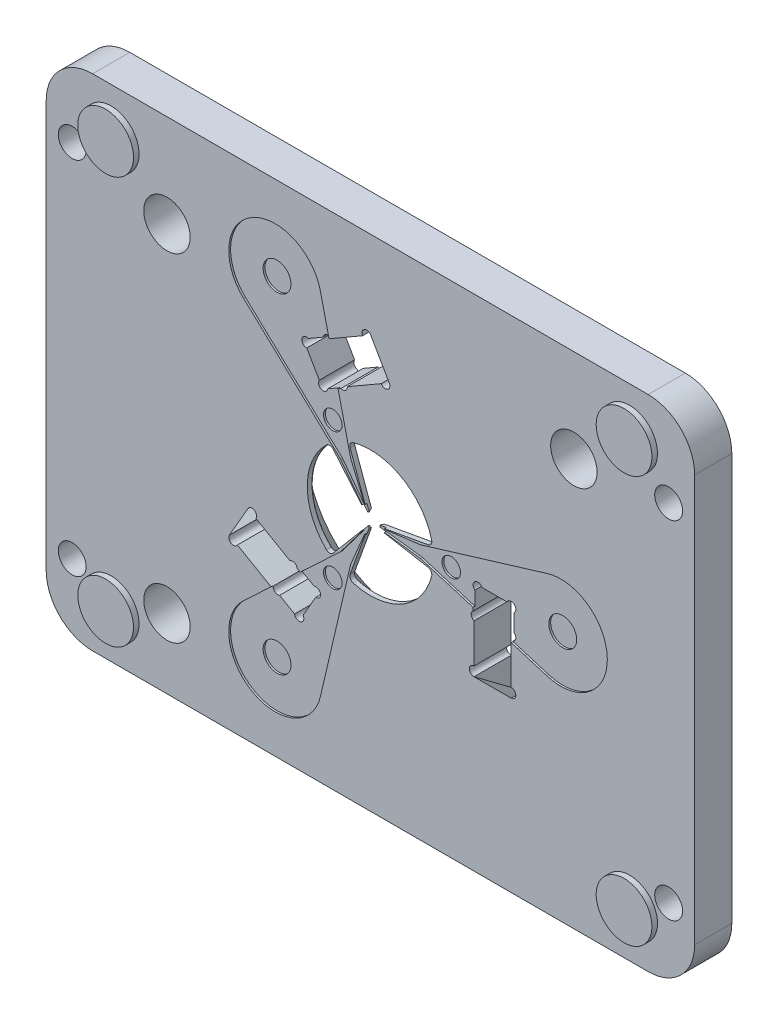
SolidWorks part; units mm, degrees
ref_plane "前基準面" through (0, 0, 0) normal (0, 0, 1) x (1, 0, 0)
ref_plane "上基準面" through (0, 0, 0) normal (0, 1, 0) x (1, 0, 0)
ref_plane "右基準面" through (0, 0, 0) normal (1, 0, 0) x (0, 0, -1)
sketch "草圖1" plane through (0, 0, 0) normal (0, 0, 1) x (1, 0, 0)
  line L1 (-38, 30) -> (38, 30)
  line L2 (-38, 30) -> (-38, -30)
  line L3 (-38, -30) -> (38, -30)
  line L4 (38, 30) -> (38, -30)
  line L5 (-38, 30) -> (38, -30) construction
  line L6 (-38, -30) -> (38, 30) construction
  point P0 (0, 0)
  point P28 (0, 0)
  dimension "D1" = 76
  dimension "D2" = 60
extrude "填料-伸長1" add sketch "草圖1" along normal blind 4
sketch "草圖2" plane through (0, 0, 4) normal (0, 0, 1) x (1, 0, 0)
  line L6 (0.3574, 0.005) -> (20.1903, 2.4807) construction
  line L7 (0.3574, -0.005) -> (20.1903, -2.4807) construction
  line L8 (0.3574, 0.005) -> (4.5094, 0.5233)
  line L9 (0.3574, -0.005) -> (4.5094, -0.5233)
  line L10 (6.1751, 0.8773) -> (19.0478, 4.7845)
  line L11 (6.1751, -0.8773) -> (19.0478, -4.7845)
  line L12 (-2.3278, -5.7864) -> (-5.3804, -18.8881)
  line L13 (-0.1744, -0.312) -> (-1.8015, -4.1669)
  line L14 (-0.183, -0.307) -> (-2.7079, -3.6436)
  line L15 (-3.8473, -4.9091) -> (-13.6674, -14.1037)
  line L16 (-3.8473, 4.9091) -> (-13.6674, 14.1037)
  line L17 (-0.183, 0.307) -> (-2.7079, 3.6436)
  line L18 (-0.1744, 0.312) -> (-1.8015, 4.1669)
  line L19 (-2.3278, 5.7864) -> (-5.3804, 18.8881)
  circle A7 centre (0, 0) radius 0.353 construction
  arc A8 (0.3574, 0.005) -> (0.3574, -0.005) centre (0.358, 0) ccw
  arc A9 (19.0478, -4.7845) -> (19.0478, 4.7845) centre (20.5, 0) ccw
  circle A10 centre (20.5, 0) radius 2.5 construction
  arc A11 (4.5094, -0.5233) -> (6.1751, -0.8773) centre (3.2707, -10.4463) cw
  arc A12 (4.5094, 0.5233) -> (6.1751, 0.8773) centre (3.2707, 10.4463) ccw
  arc A13 (-13.6674, -14.1037) -> (-5.3804, -18.8881) centre (-10.25, -17.7535) ccw
  arc A14 (-1.8015, -4.1669) -> (-2.3278, -5.7864) centre (7.4114, -8.0556) ccw
  arc A15 (-0.1744, -0.312) -> (-0.183, -0.307) centre (-0.179, -0.31) ccw
  arc A16 (-2.7079, -3.6436) -> (-3.8473, -4.9091) centre (-10.6821, 2.3906) cw
  arc A17 (-5.3804, 18.8881) -> (-13.6674, 14.1037) centre (-10.25, 17.7535) ccw
  arc A18 (-2.7079, 3.6436) -> (-3.8473, 4.9091) centre (-10.6821, -2.3906) ccw
  arc A19 (-0.183, 0.307) -> (-0.1744, 0.312) centre (-0.179, 0.31) ccw
  arc A20 (-1.8015, 4.1669) -> (-2.3278, 5.7864) centre (7.4114, 8.0556) cw
  point P17 (5.3574, -0.6291)
  point P20 (5.3574, 0.6291)
  point P46 (0, 0)
  dimension "D1" = 0.706
  dimension "D2" = 0.01
  dimension "D3" = 10
  dimension "D6" = 5
  dimension "D4" = 5
  dimension "D7" = 10
  dimension "D9" = 0.6201
  dimension "D5" = 20.5
  dimension "D8" = 3
extrude "除料-伸長1" cut sketch "草圖2" against normal blind 0.5
sketch "草圖5" plane through (0, 0, 4) normal (0, 0, 1) x (1, 0, 0)
  line L0 (-29.9, 26.9) -> (29.9, 26.9)
  line L1 (-38, 30) -> (-38, -30) construction
  line L2 (38, -30) -> (38, 30) construction
  line L3 (34.9, 21.9) -> (34.9, -21.9)
  line L4 (38, 30) -> (-38, 30) construction
  line L5 (-38, -30) -> (38, -30) construction
  line L6 (-29.9, -26.9) -> (29.9, -26.9)
  line L7 (-34.9, 21.9) -> (-34.9, -21.9)
  arc A0 (-29.9, -26.9) -> (-34.9, -21.9) centre (-29.9, -21.9) cw
  arc A1 (34.9, -21.9) -> (29.9, -26.9) centre (29.9, -21.9) cw
  arc A2 (29.9, 26.9) -> (34.9, 21.9) centre (29.9, 21.9) cw
  arc A3 (-34.9, 21.9) -> (-29.9, 26.9) centre (-29.9, 21.9) cw
  dimension "D5" = 5
  dimension "D1" = 3.1
  dimension "D2" = 3.1
  dimension "D3" = 3.1
  dimension "D4" = 3.1
extrude "除料-伸長4" cut sketch "草圖5" against normal blind 10 contours L7 A3 L0 A2 L3 A1 L6 A0 M32 M29 M30 M31
ref_plane "平面1" through (0, 0, 4) normal (0, 0, 1) x (1, 0, 0)
sketch "草圖7" plane through (0, 0, 4) normal (0, 0, 1) x (1, 0, 0)
  line L0 (0, 0) -> (34.9, 0) construction
  line L1 (34.9, 21.9) -> (34.9, -21.9) construction
  line L2 (11.05, -0.2286) -> (15.25, -0.2286)
  line L3 (15.25, -0.2286) -> (15.25, -3.3286)
  line L4 (15.25, -3.3286) -> (11.05, -3.3286)
  line L5 (11.05, -3.3286) -> (11.05, -0.2286)
  line L6 (11.05, -1.7786) -> (15.25, -1.7786) construction
  line L7 (13.15, -0.2286) -> (13.15, -3.3286) construction
  line L8 (13.15, -1.7786) -> (11.05, -0.2286) construction
  line L9 (0, 0) -> (-12.75, -22.0836) construction
  line L10 (-6.575, -11.3882) -> (-6.9709, -11.1597) construction
  line L11 (-5.7229, -9.4553) -> (-7.8229, -13.0926)
  line L16 (-7.4271, 13.3212) -> (-5.3271, 9.6839)
  line L17 (-7.4271, 13.3212) -> (-4.7424, 14.8712)
  line L18 (-4.7424, 14.8712) -> (-2.6424, 11.2339)
  line L23 (13.15, -1.7786) -> (13.15, -13.7786) construction
  line L24 (11.15, -7.7786) -> (15.15, -7.7786)
  line L25 (11.15, -7.7786) -> (11.15, -8.7786)
  line L26 (11.15, -8.7786) -> (15.15, -8.7786)
  line L27 (15.15, -8.7786) -> (15.15, -7.7786)
  line L28 (-2.6424, 11.2339) -> (-5.3271, 9.6839)
  line L33 (-6.0847, 14.0962) -> (-3.9847, 10.4589) construction
  line L34 (11.15, -8.2786) -> (15.15, -8.2786) construction
  line L35 (-5.7229, -9.4553) -> (-8.4076, -7.9053)
  line L40 (-8.4076, -7.9053) -> (-10.5076, -11.5426)
  line L41 (0, 0) -> (-12.75, 22.0836) construction
  line L42 (-6.575, 11.3882) -> (-6.1791, 11.6168) construction
  line L43 (-6.3771, 11.5025) -> (-3.6924, 13.0525) construction
  line L44 (-10.5076, -11.5426) -> (-7.8229, -13.0926)
  line L45 (-7.0653, -8.6803) -> (-9.1653, -12.3176) construction
  line L46 (-9.4576, -9.7239) -> (-6.7729, -11.2739) construction
  line L47 (-8.4076, -7.9053) -> (-7.8229, -13.0926) construction
  line L48 (-10.5076, -11.5426) -> (-5.7229, -9.4553) construction
  line L49 (-9.4576, -9.7239) -> (-17.1653, -5.2739) construction
  line L50 (-12.3114, -5.7669) -> (-14.3114, -9.231)
  line L51 (-4.7424, 14.8712) -> (-5.3271, 9.6839) construction
  line L52 (-7.4271, 13.3212) -> (-2.6424, 11.2339) construction
  line L53 (-3.6924, 13.0525) -> (4.0153, 17.5025) construction
  line L54 (-0.8386, 17.0096) -> (1.1614, 13.5455)
  line L55 (-0.8386, 17.0096) -> (0.0275, 17.5096)
  line L56 (0.0275, 17.5096) -> (2.0275, 14.0455)
  line L57 (2.0275, 14.0455) -> (1.1614, 13.5455)
  line L58 (-0.4055, 17.2596) -> (1.5945, 13.7955) construction
  line L59 (-4.3091, 13.6779) -> (-3.8841, 12.9418) construction
  line L60 (-4.7841, 14.5007) -> (-4.3091, 13.6779) construction
  line L61 (-12.3114, -5.7669) -> (-13.1775, -5.2669)
  line L62 (-13.1775, -5.2669) -> (-15.1775, -8.731)
  line L63 (-15.1775, -8.731) -> (-14.3114, -9.231)
  line L64 (-12.7445, -5.5169) -> (-14.7445, -8.981) construction
  line L65 (-10.1659, -11.3935) -> (-9.6909, -10.5708) construction
  line L66 (-9.6909, -10.5708) -> (-9.2659, -9.8347) construction
  circle A0 centre (11.35, -0.45) radius 0.5
  circle A1 centre (14.95, -0.45) radius 0.5
  circle A2 centre (14.95, -3.1071) radius 0.5
  circle A3 centre (11.35, -3.1071) radius 0.5
  circle A4 centre (13.15, -0.9886) radius 0.15 construction
  arc A11 (-13.6674, -14.1037) -> (-5.3804, -18.8881) centre (-10.25, -17.7535) ccw construction
  circle A17 centre (-7.0853, 13.1721) radius 0.5
  circle A20 centre (15.15, -8.2786) radius 0.5
  circle A21 centre (11.15, -8.2786) radius 0.5
  arc A24 (-5.3804, 18.8881) -> (-13.6674, 14.1037) centre (-10.25, 17.7535) ccw construction
  circle A25 centre (-7.8647, -12.7221) radius 0.5
  circle A26 centre (-10.1659, -11.3935) radius 0.5
  circle A27 centre (-6.0647, -9.6044) radius 0.5
  circle A28 centre (-8.3659, -8.2758) radius 0.5
  circle A29 centre (-14.7445, -8.981) radius 0.5
  circle A30 centre (-12.7445, -5.5169) radius 0.5
  circle A31 centre (-4.7841, 14.5007) radius 0.5
  circle A32 centre (-2.9841, 11.383) radius 0.5
  circle A33 centre (-5.2853, 10.0544) radius 0.5
  circle A34 centre (-0.4055, 17.2596) radius 0.5
  circle A35 centre (1.5945, 13.7955) radius 0.5
  point P24 (13.15, -7.7786)
  point P37 (-6.7729, -11.2739)
  point P52 (-6.3771, 11.5025)
  point P70 (0.1614, 15.2775)
  point P89 (-13.3114, -7.4989)
  dimension "D3" = 1
  dimension "D4" = 0.3
  dimension "D10" = 13.15
  dimension "D23" = 0.3
  dimension "D17" = 1
  dimension "D24" = 0.45
  dimension "D25" = 4
  dimension "D30" = 0.45
  dimension "D20" = 1
  dimension "D1" = 4.2
  dimension "D2" = 3.1
  dimension "D5" = 0.79
  dimension "D6" = 0.45
  dimension "D7" = 13.15
  dimension "D11" = 13.15
  dimension "D12" = 4.2
  dimension "D13" = 4
  dimension "D14" = 1
  dimension "D15" = 4.2
  dimension "D16" = 3.1
  dimension "D18" = 4.95
  dimension "D19" = 3.1
  dimension "D21" = 0.3
  dimension "D22" = 0.3
  dimension "D26" = 1
  dimension "D27" = 4.95
  dimension "D29" = 1.25
  dimension "D31" = 4
  dimension "D32" = 1
  dimension "D33" = 4.95
  dimension "D35" = 1.25
extrude "除料-伸長5" cut sketch "草圖7" against normal through all
sketch "草圖9" plane through (0, 0, 4) normal (0, 0, 1) x (1, 0, 0)
  line L0 (34.9, 21.9) -> (24.9, 21.9) construction
  line L1 (24.9, 21.9) -> (24.9, -21.9) construction
  line L2 (24.9, -21.9) -> (34.9, -21.9) construction
  line L3 (34.9, 21.9) -> (34.9, -21.9) construction
  line L4 (0, 26.9) -> (0, -26.9) construction
  line L5 (-29.9, 26.9) -> (29.9, 26.9) construction
  line L6 (-29.9, -26.9) -> (29.9, -26.9) construction
  line L7 (34.9, 0) -> (-34.9, 0) construction
  line L8 (-34.9, 21.9) -> (-34.9, -21.9) construction
  circle A0 centre (32.1, 17.9) radius 1.5
  circle A3 centre (-32.1, 19.4) radius 1.5
  circle A4 centre (-32.1, -19.4) radius 1.5
  circle A5 centre (32.1, -19.4) radius 1.5
  dimension "D2" = 3
  dimension "D5" = 2.8
  dimension "D3" = 3
  dimension "D7" = 2.8
  dimension "D1" = 10
  dimension "D4" = 4
  dimension "D6" = 2.5
extrude "除料-伸長6" cut sketch "草圖9" against normal through all
sketch "草圖13" plane through (0, 0, 4) normal (0, 0, 1) x (1, 0, 0)
  line L0 (5.358, 0.6292) -> (19.0478, 4.7845) construction
  line L1 (0.3574, 0.005) -> (20.1903, 2.4807) construction
  line L2 (20.1903, -2.4807) -> (0.3574, -0.005) construction
  line L15 (0.3574, 0.005) -> (5.358, 0.6292) construction
  line L16 (0.3574, -0.005) -> (5.358, -0.6292) construction
  line L17 (5.358, -0.6292) -> (19.0478, -4.7845) construction
  line L18 (-2.1341, -4.9548) -> (-5.3804, -18.8881) construction
  line L19 (-0.1744, -0.312) -> (-2.1341, -4.9548) construction
  line L20 (-0.183, -0.307) -> (-3.2239, -4.3256) construction
  line L21 (-3.2239, -4.3256) -> (-13.6673, -14.1036) construction
  line L22 (-3.2239, 4.3256) -> (-13.6673, 14.1036) construction
  line L23 (-0.183, 0.307) -> (-3.2239, 4.3256) construction
  line L24 (-0.1744, 0.312) -> (-2.1341, 4.9548) construction
  line L25 (-2.1341, 4.9548) -> (-5.3804, 18.8881) construction
  line L41 (0.3574, 0.005) -> (6.1962, 1.0512)
  line L42 (0.3574, -0.005) -> (6.1962, -1.0512)
  line L43 (-0.183, -0.307) -> (-4.0085, -4.8405)
  line L44 (-0.1744, -0.312) -> (-2.1877, -5.8917)
  line L45 (-0.1744, 0.312) -> (-2.1877, 5.8917)
  line L46 (-0.183, 0.307) -> (-4.0085, 4.8405)
  circle A8 centre (0, 0) radius 0.353 construction
  arc A9 (0.3574, 0.005) -> (0.3574, -0.005) centre (0.358, 0) ccw construction
  circle A10 centre (20.5, 0) radius 2.5 construction
  arc A11 (19.0478, -4.7845) -> (19.0478, 4.7845) centre (20.5, 0) ccw construction
  arc A12 (-13.6673, -14.1036) -> (-5.3804, -18.8881) centre (-10.25, -17.7535) ccw construction
  arc A13 (-0.1744, -0.312) -> (-0.183, -0.307) centre (-0.179, -0.31) ccw construction
  arc A14 (-5.3804, 18.8881) -> (-13.6673, 14.1036) centre (-10.25, 17.7535) ccw construction
  arc A15 (-0.183, 0.307) -> (-0.1744, 0.312) centre (-0.179, 0.31) ccw construction
  arc A16 (-4.7391, 4.8766) -> (-4.7391, -4.8766) centre (0, 0) ccw
  arc A17 (-0.183, 0.307) -> (-0.1744, 0.312) centre (-0.179, 0.31) ccw
  arc A18 (-0.1744, -0.312) -> (-0.183, -0.307) centre (-0.179, -0.31) ccw
  arc A19 (-1.8537, -6.5425) -> (6.5928, -1.6658) centre (0, 0) ccw
  arc A20 (0.3574, 0.005) -> (0.3574, -0.005) centre (0.358, 0) ccw
  arc A21 (6.5928, 1.6658) -> (-1.8537, 6.5425) centre (0, 0) ccw
  arc A22 (6.1962, -1.0512) -> (6.5928, -1.6658) centre (6.108, -1.5434) cw
  arc A23 (6.1962, 1.0512) -> (6.5928, 1.6658) centre (6.108, 1.5434) ccw
  arc A24 (-2.1877, 5.8917) -> (-1.8537, 6.5425) centre (-1.7174, 6.0614) cw
  arc A25 (-4.0085, 4.8405) -> (-4.7391, 4.8766) centre (-4.3906, 4.518) ccw
  arc A26 (-4.0085, -4.8405) -> (-4.7391, -4.8766) centre (-4.3906, -4.518) cw
  arc A27 (-2.1877, -5.8917) -> (-1.8537, -6.5425) centre (-1.7174, -6.0614) ccw
  point P31 (0, 0)
  point P38 (6.7034, -1.1421)
  point P41 (6.7034, 1.1421)
  point P49 (0, 0)
  dimension "D1" = 0.706
  dimension "D2" = 0.01
  dimension "D3" = 5
  dimension "D6" = 5
  dimension "D5" = 10
  dimension "D8" = 13.6
  dimension "D12" = 0.5
  dimension "D13" = 0.5
  dimension "D4" = 20.5
  dimension "D9" = 0.1
  dimension "D10" = 0.1
  dimension "D11" = 3
  dimension "D7" = 3
extrude "除料-伸長8" cut sketch "草圖13" against normal blind 0.5
sketch "草圖12" plane through (0, 0, 3.5) normal (0, 0, 1) x (1, 0, 0)
  line L0 (11.05, -2.357) -> (11.05, -0.85) construction
  line L1 (11.7983, -0.2286) -> (14.5017, -0.2286) construction
  line L2 (15.25, -0.85) -> (15.25, -2.7071) construction
  line L3 (15.0966, -3.5852) -> (19.0478, -4.7845) construction
  line L4 (19.0478, 4.7845) -> (6.1751, 0.8773) construction
  line L5 (4.5094, 0.5233) -> (0.3574, 0.005) construction
  line L6 (0.3574, -0.005) -> (4.5094, -0.5233) construction
  line L7 (6.1751, -0.8773) -> (11.05, -2.357) construction
  line L8 (-10.6531, -11.2814) -> (-13.6674, -14.1037) construction
  line L9 (-5.3804, -18.8881) -> (-2.3278, -5.7864) construction
  line L10 (-1.8015, -4.1669) -> (-0.1744, -0.312) construction
  line L11 (-0.183, -0.307) -> (-2.7079, -3.6436) construction
  line L12 (-3.8473, -4.9091) -> (-7.5662, -8.3911) construction
  line L13 (-7.5662, -8.3911) -> (-6.2611, -9.1446) construction
  line L14 (-6.0971, -10.1033) -> (-7.4488, -12.4446) construction
  line L15 (-8.3611, -12.7819) -> (-9.9695, -11.8533) construction
  line L16 (-3.4838, 10.7481) -> (-4.7889, 9.9946) construction
  line L17 (-5.7012, 10.3319) -> (-7.0529, 12.6731) construction
  line L18 (-6.8889, 13.6319) -> (-5.2805, 14.5605) construction
  line L19 (-4.4434, 14.8666) -> (-5.3804, 18.8881) construction
  line L20 (-13.6674, 14.1037) -> (-3.8473, 4.9091) construction
  line L21 (-2.7079, 3.6436) -> (-0.183, 0.307) construction
  line L22 (-0.1744, 0.312) -> (-1.8015, 4.1669) construction
  line L23 (-2.3278, 5.7864) -> (-3.4838, 10.7481) construction
  line L24 (11.05, -2.357) -> (11.05, -0.85)
  line L25 (11.7983, -0.2286) -> (14.5017, -0.2286)
  line L26 (15.25, -0.85) -> (15.25, -2.7071)
  line L27 (15.0966, -3.5852) -> (19.0478, -4.7845)
  line L28 (19.0478, 4.7845) -> (6.1751, 0.8773)
  line L29 (4.5094, 0.5233) -> (0.3574, 0.005)
  line L30 (0.3574, -0.005) -> (4.5094, -0.5233)
  line L31 (6.1751, -0.8773) -> (11.05, -2.357)
  line L32 (-10.6531, -11.2814) -> (-13.6674, -14.1037)
  line L33 (-5.3804, -18.8881) -> (-2.3278, -5.7864)
  line L34 (-1.8015, -4.1669) -> (-0.1744, -0.312)
  line L35 (-0.183, -0.307) -> (-2.7079, -3.6436)
  line L36 (-3.8473, -4.9091) -> (-7.5662, -8.3911)
  line L37 (-7.5662, -8.3911) -> (-6.2611, -9.1446)
  line L38 (-6.0971, -10.1033) -> (-7.4488, -12.4446)
  line L39 (-8.3611, -12.7819) -> (-9.9695, -11.8533)
  line L40 (-3.4838, 10.7481) -> (-4.7889, 9.9946)
  line L41 (-5.7012, 10.3319) -> (-7.0529, 12.6731)
  line L42 (-6.8889, 13.6319) -> (-5.2805, 14.5605)
  line L43 (-4.4434, 14.8666) -> (-5.3804, 18.8881)
  line L44 (-13.6674, 14.1037) -> (-3.8473, 4.9091)
  line L45 (-2.7079, 3.6436) -> (-0.183, 0.307)
  line L46 (-0.1744, 0.312) -> (-1.8015, 4.1669)
  line L47 (-2.3278, 5.7864) -> (-3.4838, 10.7481)
  arc A0 (11.7983, -0.2286) -> (11.05, -0.85) centre (11.35, -0.45) ccw construction
  arc A1 (15.25, -0.85) -> (14.5017, -0.2286) centre (14.95, -0.45) ccw construction
  arc A2 (15.0966, -3.5852) -> (15.25, -2.7071) centre (14.95, -3.1071) ccw construction
  arc A3 (19.0478, -4.7845) -> (19.0478, 4.7845) centre (20.5, 0) ccw construction
  arc A4 (4.5094, 0.5233) -> (6.1751, 0.8773) centre (3.2707, 10.4463) ccw construction
  arc A6 (6.1751, -0.8773) -> (4.5094, -0.5233) centre (3.2707, -10.4463) ccw construction
  arc A7 (-10.6531, -11.2814) -> (-9.9695, -11.8533) centre (-10.1659, -11.3935) ccw construction
  arc A8 (-13.6674, -14.1037) -> (-5.3804, -18.8881) centre (-10.25, -17.7535) ccw construction
  arc A9 (-1.8015, -4.1669) -> (-2.3278, -5.7864) centre (7.4114, -8.0556) ccw construction
  arc A11 (-3.8473, -4.9091) -> (-2.7079, -3.6436) centre (-10.6821, 2.3906) ccw construction
  arc A12 (-6.0971, -10.1033) -> (-6.2611, -9.1446) centre (-6.0647, -9.6044) ccw construction
  arc A13 (-8.3611, -12.7819) -> (-7.4488, -12.4446) centre (-7.8647, -12.7221) ccw construction
  arc A14 (-5.7012, 10.3319) -> (-4.7889, 9.9946) centre (-5.2853, 10.0544) ccw construction
  arc A15 (-6.8889, 13.6319) -> (-7.0529, 12.6731) centre (-7.0853, 13.1721) ccw construction
  arc A16 (-4.4434, 14.8666) -> (-5.2805, 14.5605) centre (-4.7841, 14.5007) ccw construction
  arc A17 (-5.3804, 18.8881) -> (-13.6674, 14.1037) centre (-10.25, 17.7535) ccw construction
  arc A18 (-2.7079, 3.6436) -> (-3.8473, 4.9091) centre (-10.6821, -2.3906) ccw construction
  arc A20 (-2.3278, 5.7864) -> (-1.8015, 4.1669) centre (7.4114, 8.0556) ccw construction
  arc A21 (11.7983, -0.2286) -> (11.05, -0.85) centre (11.35, -0.45) ccw
  arc A22 (15.25, -0.85) -> (14.5017, -0.2286) centre (14.95, -0.45) ccw
  arc A23 (15.0966, -3.5852) -> (15.25, -2.7071) centre (14.95, -3.1071) ccw
  arc A24 (19.0478, -4.7845) -> (19.0478, 4.7845) centre (20.5, 0) ccw
  arc A25 (4.5094, 0.5233) -> (6.1751, 0.8773) centre (3.2707, 10.4463) ccw
  arc A26 (0.3574, 0.005) -> (0.3574, -0.005) centre (0.358, 0) ccw
  arc A27 (6.1751, -0.8773) -> (4.5094, -0.5233) centre (3.2707, -10.4463) ccw
  arc A28 (-10.6531, -11.2814) -> (-9.9695, -11.8533) centre (-10.1659, -11.3935) ccw
  arc A29 (-13.6674, -14.1037) -> (-5.3804, -18.8881) centre (-10.25, -17.7535) ccw
  arc A30 (-1.8015, -4.1669) -> (-2.3278, -5.7864) centre (7.4114, -8.0556) ccw
  arc A31 (-0.1744, -0.312) -> (-0.183, -0.307) centre (-0.179, -0.31) ccw
  arc A32 (-3.8473, -4.9091) -> (-2.7079, -3.6436) centre (-10.6821, 2.3906) ccw
  arc A33 (-6.0971, -10.1033) -> (-6.2611, -9.1446) centre (-6.0647, -9.6044) ccw
  arc A34 (-8.3611, -12.7819) -> (-7.4488, -12.4446) centre (-7.8647, -12.7221) ccw
  arc A35 (-5.7012, 10.3319) -> (-4.7889, 9.9946) centre (-5.2853, 10.0544) ccw
  arc A36 (-6.8889, 13.6319) -> (-7.0529, 12.6731) centre (-7.0853, 13.1721) ccw
  arc A37 (-4.4434, 14.8666) -> (-5.2805, 14.5605) centre (-4.7841, 14.5007) ccw
  arc A38 (-5.3804, 18.8881) -> (-13.6674, 14.1037) centre (-10.25, 17.7535) ccw
  arc A39 (-2.7079, 3.6436) -> (-3.8473, 4.9091) centre (-10.6821, -2.3906) ccw
  arc A40 (-0.183, 0.307) -> (-0.1744, 0.312) centre (-0.179, 0.31) ccw
  arc A41 (-2.3278, 5.7864) -> (-1.8015, 4.1669) centre (7.4114, 8.0556) ccw
  circle A42 centre (0, 0) radius 0.353 construction
  dimension "D1" = 0.005
extrude "填料-伸長2" add sketch "草圖12" along normal blind 0.5
sketch "草圖15" plane through (0, 0, 0) normal (0, 1, 0) x (1, 0, 0)
  line L0 (0.0275, 0) -> (0.0275, -4.5737) construction
  line L7 (-29.9, 0) -> (29.9, 0) construction
  line L8 (11.0275, 0) -> (0.0275, 0)
  line L10 (0.0275, -3.5) -> (6.8275, -3.5)
  line L11 (-1.8537, -3.5) -> (6.5928, -3.5) construction
  line L12 (6.8275, -3.5) -> (11.0275, 0)
  line L13 (0.0275, -3.5) -> (0.0275, 0)
  dimension "D1" = 6.8
  dimension "D2" = 11
revolve "除料-旋轉2" cut sketch "草圖15" angle 360 about L0
sketch "草圖16" plane through (0, 0, 0) normal (0, 1, 0) x (1, 0, 0)
  line L0 (0, 0) -> (0, -4.8454) construction
  line L1 (0.353, -4.18) -> (0.353, -3.5)
  line L2 (6.8275, -3.5) -> (0.0137, -3.5) construction
  line L3 (0.353, -3.5) -> (0.7456, -3.5)
  line L4 (0.7456, -3.5) -> (0.353, -4.18)
  line L5 (-29.59, -4) -> (29.59, -4) construction
  dimension "D1" = 0.353
  dimension "D2" = 30
  dimension "D3" = 0.18
revolve "除料-旋轉3" cut sketch "草圖16" angle 360 about L0
sketch "草圖17" plane through (0, 0, 4) normal (0, 0, 1) x (1, 0, 0)
  line L0 (-29.9, 26.9) -> (29.9, 26.9) construction
  line L1 (-34.9, 21.9) -> (-34.9, -21.9) construction
  line L2 (0, 26.9) -> (0, -26.9) construction
  line L3 (-29.9, -26.9) -> (29.9, -26.9) construction
  circle A0 centre (-21.9, 16.9) radius 2.5
  circle A1 centre (21.9, 16.9) radius 2.5
  circle A2 centre (-21.9, -19.4) radius 2.5
  dimension "D3" = 5
  dimension "D4" = 5
  dimension "D1" = 10
  dimension "D2" = 13
  dimension "D5" = 7.5
extrude "除料-伸長9" cut sketch "草圖17" against normal through all
sketch "草圖18" plane through (0, 0, 4) normal (0, 0, 1) x (1, 0, 0)
  line L0 (13.15, -0.2286) -> (13.15, -8.7786) construction
  line L1 (11.7983, -0.2286) -> (14.5017, -0.2286) construction
  line L2 (11.15, -8.7786) -> (15.15, -8.7786) construction
  line L3 (14.2511, -3.3286) -> (11.7983, -3.3286) construction
  line L4 (11.15, -3.3286) -> (15.15, -3.3286)
  line L5 (11.15, -3.3286) -> (11.15, -7.7786)
  line L6 (11.15, -7.7786) -> (15.15, -7.7786)
  line L7 (15.15, -3.3286) -> (15.15, -7.7786)
  line L8 (11.15, -3.3286) -> (15.15, -7.7786) construction
  line L9 (11.15, -7.7786) -> (15.15, -3.3286) construction
  line L10 (-6.3771, 11.5025) -> (1.0275, 15.7775) construction
  line L11 (-5.7012, 10.3319) -> (-7.0529, 12.6731) construction
  line L12 (0.0275, 17.5096) -> (2.0275, 14.0455) construction
  line L13 (-0.8386, 17.0096) -> (1.1614, 13.5455) construction
  line L14 (-0.8386, 17.0096) -> (1.1614, 13.5455)
  line L15 (-0.8386, 17.0096) -> (-4.6924, 14.7846)
  line L16 (-4.6924, 14.7846) -> (-2.6924, 11.3205)
  line L17 (1.1614, 13.5455) -> (-2.6924, 11.3205)
  line L18 (-0.8386, 17.0096) -> (-2.6924, 11.3205) construction
  line L19 (-4.6924, 14.7846) -> (1.1614, 13.5455) construction
  line L20 (-4.2429, 14.0061) -> (-3.0165, 11.8819) construction
  line L21 (-6.7729, -11.2739) -> (-14.1775, -6.9989) construction
  line L22 (-6.0971, -10.1033) -> (-7.4488, -12.4446) construction
  line L23 (-13.1775, -5.2669) -> (-15.1775, -8.731) construction
  line L24 (-12.3114, -5.7669) -> (-14.3114, -9.231) construction
  line L25 (-10.4576, -11.456) -> (-8.4576, -7.9919)
  line L26 (-10.4576, -11.456) -> (-14.3114, -9.231)
  line L27 (-14.3114, -9.231) -> (-12.3114, -5.7669)
  line L28 (-8.4576, -7.9919) -> (-12.3114, -5.7669)
  line L29 (-10.4576, -11.456) -> (-12.3114, -5.7669) construction
  line L30 (-14.3114, -9.231) -> (-8.4576, -7.9919) construction
  line L31 (-8.7818, -8.5533) -> (-10.0082, -10.6776) construction
  point P6 (13.15, -5.5536)
  point P20 (-1.7655, 14.165)
  point P29 (-11.3845, -8.6114)
extrude "除料-伸長10" cut sketch "草圖18" against normal blind 0.9
sketch "草圖20" plane through (0, 0, 4) normal (0, 0, 1) x (1, 0, 0)
  line L0 (20.1903, 2.4807) -> (0.3574, 0.005) construction
  line L1 (0.3574, -0.005) -> (20.1903, -2.4807) construction
  line L2 (0.3574, 0.005) -> (5.358, 0.6292)
  line L3 (0.3574, -0.005) -> (5.358, -0.6292)
  line L4 (5.358, 0.6292) -> (19.0478, 4.7845)
  line L5 (5.358, -0.6292) -> (19.0478, -4.7845)
  line L6 (-0.183, -0.307) -> (-3.2239, -4.3256)
  line L7 (-3.2239, -4.3256) -> (-13.6673, -14.1036)
  line L8 (-2.1341, -4.9548) -> (-5.3804, -18.8881)
  line L9 (-0.1744, -0.312) -> (-2.1341, -4.9548)
  line L10 (-7.9468, -18.7257) -> (-0.1744, -0.312) construction
  line L11 (-0.183, -0.307) -> (-12.2436, -16.245) construction
  line L12 (-0.1744, 0.312) -> (-2.1341, 4.9548)
  line L13 (-2.1341, 4.9548) -> (-5.3804, 18.8881)
  line L14 (-3.2239, 4.3256) -> (-13.6673, 14.1036)
  line L15 (-0.183, 0.307) -> (-3.2239, 4.3256)
  line L16 (-12.2436, 16.245) -> (-0.183, 0.307) construction
  line L17 (-0.1744, 0.312) -> (-7.9468, 18.7257) construction
  circle A0 centre (0, 0) radius 0.353 construction
  arc A1 (0.3574, 0.005) -> (0.3574, -0.005) centre (0.358, 0) ccw
  circle A2 centre (20.5, 0) radius 2.5 construction
  arc A3 (19.0478, -4.7845) -> (19.0478, 4.7845) centre (20.5, 0) ccw
  arc A4 (-0.1744, -0.312) -> (-0.183, -0.307) centre (-0.179, -0.31) ccw
  arc A5 (-13.6673, -14.1036) -> (-5.3804, -18.8881) centre (-10.25, -17.7535) ccw
  circle A6 centre (-10.25, -17.7535) radius 2.5 construction
  arc A7 (-0.183, 0.307) -> (-0.1744, 0.312) centre (-0.179, 0.31) ccw
  arc A8 (-5.3804, 18.8881) -> (-13.6673, 14.1036) centre (-10.25, 17.7535) ccw
  circle A9 centre (-10.25, 17.7535) radius 2.5 construction
  point P38 (0, 0)
  dimension "D1" = 0.706
  dimension "D2" = 0.01
  dimension "D3" = 5
  dimension "D5" = 10
  dimension "D4" = 20.5
  dimension "D6" = 5
  dimension "D7" = 3
extrude "除料-伸長11" cut sketch "草圖20" against normal blind 0.2
sketch "草圖21" plane through (0, 0, 0) normal (0, 1, 0) x (1, 0, 0)
  line L0 (0, 0) -> (0, -4.6448) construction
  line L1 (0.353, 0) -> (0.353, -4.25)
  line L2 (10.998, 0) -> (-5.5861, 0) construction
  line L3 (0.353, -4.25) -> (0.553, -4.25)
  line L4 (0.553, -4.25) -> (3.0067, 0)
  line L5 (3.0067, 0) -> (0.353, 0)
  line L6 (0.4566, -4) -> (5.358, -4) construction
  dimension "D1" = 0.706
  dimension "D2" = 0.2
  dimension "D3" = 0.25
  dimension "D4" = 30
revolve "除料-旋轉4" cut sketch "草圖21" angle 360 about L0
ref_plane "平面2" through (11.15, 0, 0) normal (1, 0, 0) x (0, 0, -1)
sketch "草圖22" plane through (11.15, 0, 0) normal (1, 0, 0) x (0, 0, -1)
  line L1 (-4, -8.7786) -> (0, -8.7786)
  line L3 (0, -8.7786) -> (0, -11.7786)
  line L10 (0, -10.1033) -> (0, -12.4446) construction
  line L11 (0, -11.7786) -> (-4, -8.7786)
  line L13 (0, -7.7786) -> (-3.1, -7.7786)
  line L14 (-3.1, -7.7786) -> (-4, -7.7786)
  line L15 (-4, -7.7786) -> (-4, -8.7786)
  line L16 (-4, -8.7786) -> (0, -8.7786)
  line L17 (0, -8.7786) -> (0, -7.7786)
  line L18 (0, -7.7786) -> (-3.1, -7.7786) construction
  line L19 (-3.1, -7.7786) -> (-4, -7.7786) construction
  line L20 (-4, -7.7786) -> (-4, -8.7786) construction
  line L21 (-4, -8.7786) -> (0, -8.7786) construction
  line L22 (0, -8.7786) -> (0, -7.7786) construction
  dimension "D1" = 0
  dimension "D2" = 3
extrude "除料-伸長12" cut sketch "草圖22" along normal blind 4
ref_plane "平面3" through (-5.575, -9.6562, 0) normal (-0.5, -0.866, 0) x (-0.866, 0.5, 0)
sketch "草圖23" plane through (-5.575, -9.6562, 0) normal (-0.5, -0.866, 0) x (-0.866, 0.5, 0)
  line L1 (8.7786, -4) -> (8.7786, 0)
  line L2 (8.7786, 0) -> (11.7786, 0)
  line L11 (39.3442, 0) -> (-12.4442, 0) construction
  line L12 (11.7786, 0) -> (8.7786, -4)
  line L14 (7.7786, 0) -> (7.7786, -3.1)
  line L15 (7.7786, -3.1) -> (7.7786, -4)
  line L16 (7.7786, -4) -> (8.7786, -4)
  line L17 (8.7786, -4) -> (8.7786, 0)
  line L18 (8.7786, 0) -> (7.7786, 0)
  line L19 (7.7786, 0) -> (7.7786, -3.1) construction
  line L20 (7.7786, -3.1) -> (7.7786, -4) construction
  line L21 (7.7786, -4) -> (8.7786, -4) construction
  line L22 (8.7786, -4) -> (8.7786, 0) construction
  line L23 (8.7786, 0) -> (7.7786, 0) construction
  dimension "D1" = 0
  dimension "D2" = 3
extrude "除料-伸長13" cut sketch "草圖23" along normal blind 4
ref_plane "平面4" through (-7.575, 13.1203, 0) normal (0.5, -0.866, 0) x (-0.866, -0.5, 0)
sketch "草圖24" plane through (-7.575, 13.1203, 0) normal (0.5, -0.866, 0) x (-0.866, -0.5, 0)
  line L5 (-8.7786, -4) -> (-8.7786, 0)
  line L6 (-8.7786, 0) -> (-11.7786, 0)
  line L7 (12.4442, 0) -> (-39.3442, 0) construction
  line L8 (-11.7786, 0) -> (-8.7786, -4)
  line L10 (-7.7786, 0) -> (-8.7786, 0)
  line L11 (-8.7786, 0) -> (-8.7786, -4)
  line L12 (-8.7786, -4) -> (-7.7786, -4)
  line L13 (-7.7786, -4) -> (-7.7786, -3.1)
  line L14 (-7.7786, -3.1) -> (-7.7786, 0)
  line L15 (-7.7786, 0) -> (-8.7786, 0) construction
  line L16 (-8.7786, 0) -> (-8.7786, -4) construction
  line L17 (-8.7786, -4) -> (-7.7786, -4) construction
  line L18 (-7.7786, -4) -> (-7.7786, -3.1) construction
  line L19 (-7.7786, -3.1) -> (-7.7786, 0) construction
  dimension "D1" = 0
  dimension "D2" = 3
extrude "除料-伸長14" cut sketch "草圖24" along normal blind 4
ref_plane "平面5" through (0, 0, 4) normal (0, 0, 1) x (1, 0, 0)
sketch "草圖26" plane through (0, 0, 4) normal (0, 0, 1) x (1, 0, 0)
  line L0 (0, 0) -> (34.9, 0) construction
  line L5 (34.9, 21.9) -> (34.9, -21.9) construction
  line L6 (1.5193, 0) -> (1.5193, 0.15) construction
  line L7 (5.358, 0.6292) -> (0.6957, 0.0472) construction
  circle A0 centre (0, 0) radius 1.5266
  dimension "D1" = 0.15
extrude "除料-伸長15" cut sketch "草圖26" against normal blind 0.2
ref_plane "平面6" through (0, 0, 3.8) normal (0, 0, 1) x (1, 0, 0)
sketch "草圖27" plane through (0, 0, 3.8) normal (0, 0, 1) x (1, 0, 0)
  line L0 (0, 0) -> (34.9, 0) construction
  line L1 (34.9, 21.9) -> (34.9, -21.9) construction
  circle A0 centre (20.5, 0) radius 1.5
  circle A1 centre (8.5, 0) radius 1
  circle A2 centre (-4.25, -7.3612) radius 1
  circle A3 centre (-10.25, -17.7535) radius 1.5
  circle A4 centre (-4.25, 7.3612) radius 1
  circle A5 centre (-10.25, 17.7535) radius 1.5
  point P20 (0, 0)
  dimension "D1" = 3
  dimension "D2" = 2
  dimension "D3" = 8.5
  dimension "D4" = 3
extrude "除料-伸長16" cut sketch "草圖27" against normal blind 0.2
sketch "草圖29" plane through (0, 0, 4) normal (0, 0, 1) x (1, 0, 0)
  line L0 (0, 26.9) -> (0, -26.9) construction
  line L1 (-29.9, 26.9) -> (29.9, 26.9) construction
  line L2 (-29.9, -26.9) -> (29.9, -26.9) construction
  line L3 (-34.9, 0) -> (34.9, 0) construction
  line L4 (-34.9, 21.9) -> (-34.9, -21.9) construction
  line L5 (34.9, 21.9) -> (34.9, -21.9) construction
  circle A0 centre (-27.9, 21.9) radius 3
  circle A1 centre (27.9, 21.9) radius 3
  circle A2 centre (27.9, -21.9) radius 3
  circle A3 centre (-27.9, -21.9) radius 3
  dimension "D1" = 6
  dimension "D2" = 5
  dimension "D3" = 7
extrude "填料-伸長3" add sketch "草圖29" along normal blind 0.6
sketch "草圖30" plane through (0, 0, 3.1) normal (0, 0, 1) x (1, 0, 0)
  line L4 (-4.3682, 14.2231) -> (-3.0165, 11.8819)
  line L5 (-2.4873, 11.4389) -> (1.1614, 13.5455)
  line L6 (1.1614, 13.5455) -> (-0.8386, 17.0096)
  line L7 (-0.8386, 17.0096) -> (-4.4873, 14.903)
  line L8 (-4.3682, 14.2231) -> (-3.0165, 11.8819)
  line L9 (-2.4873, 11.4389) -> (1.1614, 13.5455)
  line L10 (1.1614, 13.5455) -> (-0.8386, 17.0096)
  line L11 (-0.8386, 17.0096) -> (-4.4873, 14.903)
  line L12 (-10.1335, -10.8946) -> (-8.7818, -8.5533)
  line L13 (-8.6627, -7.8735) -> (-12.3114, -5.7669)
  line L14 (-12.3114, -5.7669) -> (-14.3114, -9.231)
  line L15 (-14.3114, -9.231) -> (-10.6627, -11.3376)
  line L16 (-10.1335, -10.8946) -> (-8.7818, -8.5533)
  line L17 (-8.6627, -7.8735) -> (-12.3114, -5.7669)
  line L18 (-12.3114, -5.7669) -> (-14.3114, -9.231)
  line L19 (-14.3114, -9.231) -> (-10.6627, -11.3376)
  line L20 (14.5017, -3.3286) -> (11.7983, -3.3286)
  line L21 (11.15, -3.5654) -> (11.15, -7.7786)
  line L22 (11.15, -7.7786) -> (15.15, -7.7786)
  line L23 (15.15, -7.7786) -> (15.15, -3.5654)
  line L24 (14.5017, -3.3286) -> (11.7983, -3.3286)
  line L25 (11.15, -3.5654) -> (11.15, -7.7786)
  line L26 (11.15, -7.7786) -> (15.15, -7.7786)
  line L27 (15.15, -7.7786) -> (15.15, -3.5654)
  arc A2 (-2.4873, 11.4389) -> (-3.0165, 11.8819) centre (-2.9841, 11.383) ccw
  arc A3 (-4.3682, 14.2231) -> (-4.4873, 14.903) centre (-4.7841, 14.5007) ccw
  arc A4 (-2.4873, 11.4389) -> (-3.0165, 11.8819) centre (-2.9841, 11.383) ccw
  arc A5 (-4.3682, 14.2231) -> (-4.4873, 14.903) centre (-4.7841, 14.5007) ccw
  arc A6 (-10.1335, -10.8946) -> (-10.6627, -11.3376) centre (-10.1659, -11.3935) ccw
  arc A7 (-8.6627, -7.8735) -> (-8.7818, -8.5533) centre (-8.3659, -8.2758) ccw
  arc A8 (-10.1335, -10.8946) -> (-10.6627, -11.3376) centre (-10.1659, -11.3935) ccw
  arc A9 (-8.6627, -7.8735) -> (-8.7818, -8.5533) centre (-8.3659, -8.2758) ccw
  arc A10 (14.5017, -3.3286) -> (15.15, -3.5654) centre (14.95, -3.1071) ccw
  arc A11 (11.15, -3.5654) -> (11.7983, -3.3286) centre (11.35, -3.1071) ccw
  arc A12 (14.5017, -3.3286) -> (15.15, -3.5654) centre (14.95, -3.1071) ccw
  arc A13 (11.15, -3.5654) -> (11.7983, -3.3286) centre (11.35, -3.1071) ccw
  dimension "D1" = 0
  dimension "D2" = 0
  dimension "D3" = 0
extrude "除料-伸長17" cut sketch "草圖30" against normal through all
